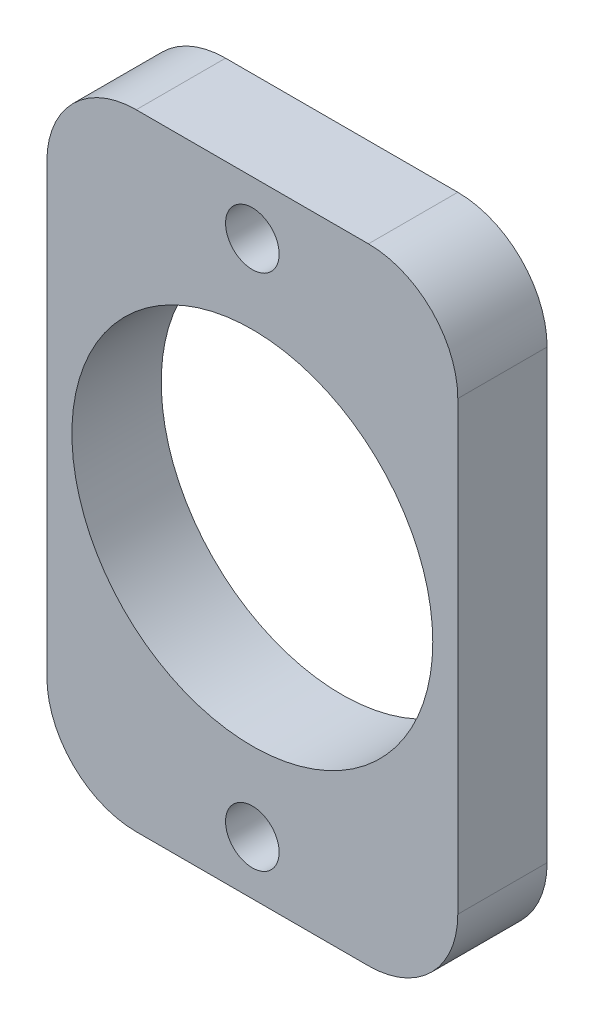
SolidWorks part; units mm, degrees
ref_plane "Plan de face" through (0, 0, 0) normal (0, 0, 1) x (1, 0, 0)
ref_plane "Plan de dessus" through (0, 0, 0) normal (0, 1, 0) x (1, 0, 0)
ref_plane "Plan de droite" through (0, 0, 0) normal (1, 0, 0) x (0, 0, -1)
sketch "Esquisse1" plane through (0, 0, 0) normal (0, 0, 1) x (1, 0, 0)
  line L0 (0, 0) -> (22.8241, 0) construction
  line L1 (0, 14.5) -> (0, -14.5) construction
  line L3 (-11.5, 17.5) -> (11.5, 17.5)
  line L4 (-11.5, 17.5) -> (-11.5, -17.5)
  line L5 (-11.5, -17.5) -> (11.5, -17.5)
  line L6 (11.5, 17.5) -> (11.5, -17.5)
  circle A0 centre (0, 0) radius 10.1
  circle A1 centre (0, 14.5) radius 1.5
  circle A2 centre (0, -14.5) radius 1.5
  dimension "D2" = 20.2
  dimension "D3" = 3
  dimension "D1" = 29
  dimension "D4" = 23
  dimension "D5" = 3
extrude "Boss.-Extru.1" add sketch "Esquisse1" along normal blind 5
fillet "Congé1" radius 5 4 edges at (11.5, -17.5, 2.5) (-11.5, -17.5, 2.5) (-11.5, 17.5, 2.5) (11.5, 17.5, 2.5)
